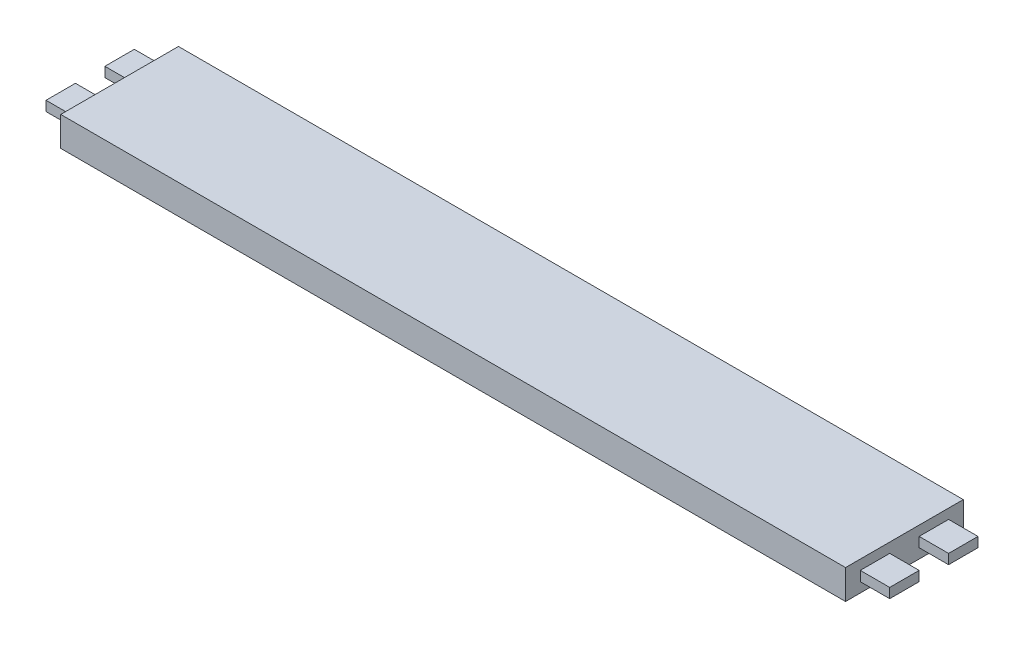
SolidWorks part; units mm, degrees
ref_plane "Alzado" through (0, 0, 0) normal (0, 0, 1) x (1, 0, 0)
ref_plane "Planta" through (0, 0, 0) normal (0, 1, 0) x (1, 0, 0)
ref_plane "Vista lateral" through (0, 0, 0) normal (1, 0, 0) x (0, 0, -1)
sketch "Croquis1" plane through (0, 0, 0) normal (0, 1, 0) x (1, 0, 0)
  line L1 (0, 0) -> (200, 0)
  line L2 (0, 0) -> (0, 60)
  line L3 (0, 60) -> (200, 60)
  line L4 (200, 0) -> (200, 60)
  dimension "D1" = 60
  dimension "D2" = 200
extrude "Saliente-Extruir1" add sketch "Croquis1" along normal blind 15
sketch "Croquis2" plane through (200, 0, 0) normal (1, 0, 0) x (0, 0, -1)
  line L0 (0, 15) -> (0, 0) construction
  line L1 (7.5, 10) -> (22.5, 10)
  line L2 (7.5, 10) -> (7.5, 5)
  line L3 (7.5, 5) -> (22.5, 5)
  line L4 (22.5, 10) -> (22.5, 5)
  line L5 (37.5, 10) -> (52.5, 10)
  line L6 (37.5, 10) -> (37.5, 5)
  line L7 (37.5, 5) -> (52.5, 5)
  line L8 (52.5, 10) -> (52.5, 5)
  line L9 (0, 0) -> (60, 0) construction
  dimension "D1" = 15
  dimension "D2" = 15
  dimension "D3" = 7.5
  dimension "D4" = 15
  dimension "D5" = 5
  dimension "D6" = 5
  dimension "D7" = 5
  dimension "D8" = 5
extrude "Saliente-Extruir2" add sketch "Croquis2" along normal blind 15
mirror "Simetría1" about plane through (0, 15, 0) normal (1, 0, 0) of "Saliente-Extruir2", "Saliente-Extruir1"
